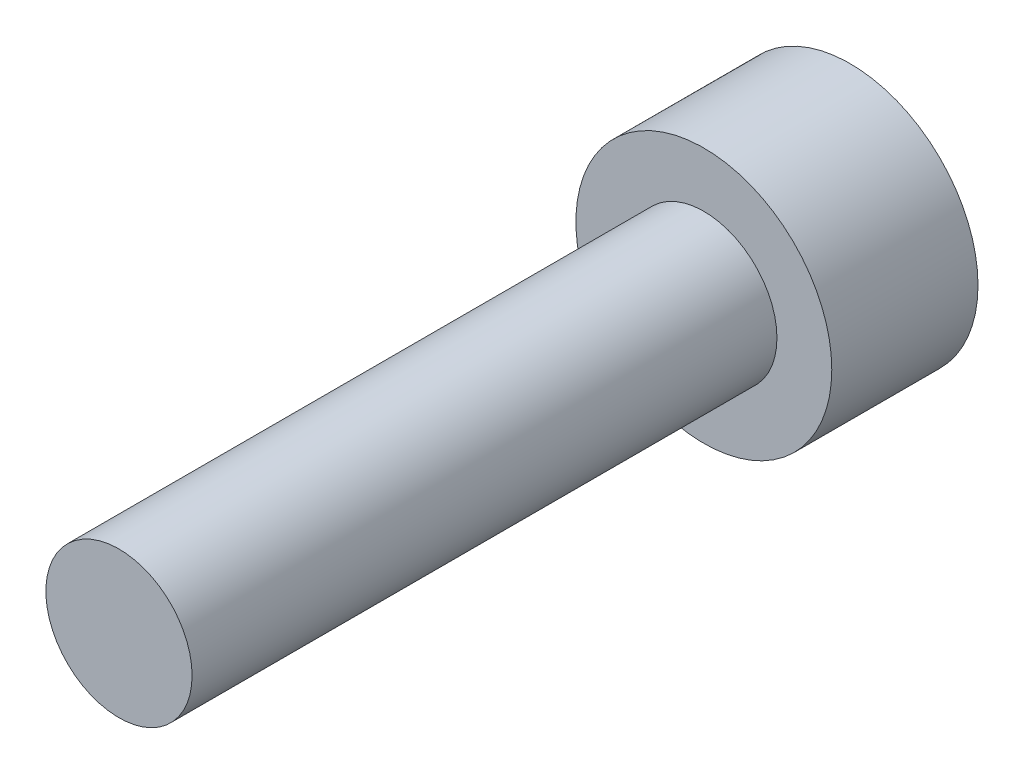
SolidWorks part; units mm, degrees
ref_plane "Front Plane" through (0, 0, 0) normal (0, 0, 1) x (1, 0, 0)
ref_plane "Top Plane" through (0, 0, 0) normal (0, 1, 0) x (1, 0, 0)
ref_plane "Right Plane" through (0, 0, 0) normal (1, 0, 0) x (0, 0, -1)
sketch "Sketch6" plane through (0, 0, 0) normal (1, 0, 0) x (0, 0, -1)
  line L0 (-16, 0) -> (22.525, 0) construction
  line L1 (3.85, 0) -> (-3.85, 0) construction
  line L2 (-16, 0) -> (-16, -2)
  line L3 (-16, -2) -> (0, -2)
  line L4 (0, 3.85) -> (0, -3.85) construction
  line L5 (0, -2) -> (0, -3.5)
  line L6 (0, -3.5) -> (4, -3.5)
  line L7 (4, -3.5) -> (4, 0)
  line L8 (4, 0) -> (-16, 0)
  dimension "L" = 16
  dimension "H" = 4
  dimension "A" = 7
  dimension "D" = 4
revolve "Revolve1" add sketch "Sketch6" angle 360 about L0
sketch "Sketch7" plane through (0, 0, -4) normal (0, 0, -1) x (-1, 0, 0)
  line L2 (-1.5, 0.866) -> (-1.5, -0.866)
  line L4 (-1.5, -0.866) -> (0, -1.7321)
  line L5 (0, -1.7321) -> (1.5, -0.866)
  line L6 (1.5, -0.866) -> (1.5, 0.866)
  line L7 (1.5, 0.866) -> (0, 1.7321)
  line L8 (0, 1.7321) -> (-1.5, 0.866)
  circle A0 centre (0, 0) radius 1.5 construction
  dimension "J" = 3
extrude "HEX" cut sketch "Sketch7" against normal blind 3
